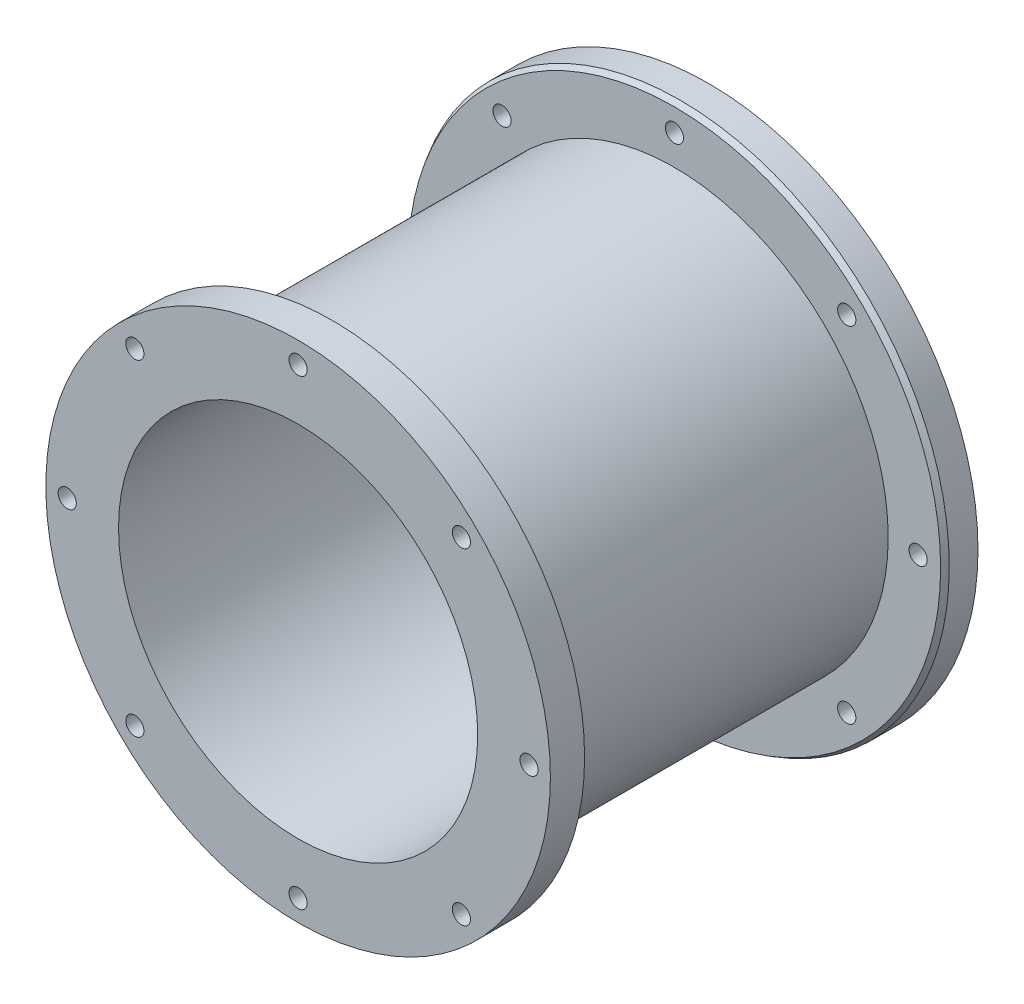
SolidWorks part; units mm, degrees
ref_plane "FRONT" through (0, 0, 0) normal (0, 0, 1) x (1, 0, 0)
ref_plane "TOP" through (0, 0, 0) normal (0, 1, 0) x (1, 0, 0)
ref_plane "RT-SIDE" through (0, 0, 0) normal (1, 0, 0) x (0, 0, -1)
sketch "Sketch1" plane through (0, 0, 0) normal (0, 0, 1) x (1, 0, 0)
  circle A0 centre (0, 0) radius 66.675
  circle A1 centre (0, 0) radius 100.0125
  dimension "D1" = 200.025
  dimension "D2" = 133.35
extrude "Base-Extrude" add sketch "Sketch1" along normal blind 12.7
sketch "Sketch2" plane through (0, 0, 12.7) normal (0, 0, 1) x (1, 0, 0)
  circle A0 centre (0, 0) radius 66.675
  circle A1 centre (0, 0) radius 79.375
  circle A2 centre (0, 0) radius 66.675 construction
  dimension "D2" = 158.75
  dimension "D1" = 12.7
extrude "Boss-Extrude1" add sketch "Sketch2" along normal blind 127
ref_plane "Plane1" through (0, 0, 76.2) normal (0, 0, 1) x (1, 0, 0)
hole_wizard "1/4 Clearance" positions "Sketch4" profile "Sketch3" hole size "1/4" standard "Ansi Inch"
sketch "Sketch4" plane through (0, 0, 0) normal (0, 0, -1) x (-1, 0, 0)
  line L0 (0, 0) -> (0, 90.4875) construction
  point P0 (0, 90.4875)
  dimension "D1" = 90.4875
sketch "Sketch3" plane through (0, 90.4875, 0) normal (1, 0, 0) x (0, 1, 0)
  line L0 (0, 0) -> (0, 139.7)
  line L1 (0, 139.7) -> (3.3782, 139.7)
  line L2 (3.3782, 139.7) -> (3.3782, 0)
  line L5 (3.3782, 0) -> (0, 0)
  line L11 (0, -6.35) -> (0, 107.95) construction
  dimension "Thru Hole Dia." = 6.7564
  dimension "Thru Hole Depth" = 139.7
pattern_circular "CirPattern1" count 8 over 360
sketch "Sketch5" plane through (0, 0, 139.7) normal (0, 0, 1) x (1, 0, 0)
  circle A0 centre (0, 0) radius 66.675
  circle A1 centre (0, 0) radius 93.6625
  dimension "D1" = 187.325
extrude "Boss-Extrude2" add sketch "Sketch5" along normal blind 12.7
hole_wizard "1/4 clearance-2" positions "Sketch7" profile "Sketch6" hole size "1/4" standard "Ansi Inch"
sketch "Sketch7" plane through (0, 0, 152.4) normal (0, 0, 1) x (1, 0, 0)
  line L0 (0, 0) -> (0, 85.725) construction
  point P0 (0, 85.725)
  dimension "D1" = 85.725
sketch "Sketch6" plane through (0, 85.725, 152.4) normal (1, 0, 0) x (0, -1, 0)
  line L0 (0, 0) -> (0, 33.7798)
  line L1 (0, 33.7798) -> (3.3782, 31.75)
  line L2 (3.3782, 31.75) -> (3.3782, 0)
  line L5 (3.3782, 0) -> (0, 0)
  line L10 (0, 33.7798) -> (-3.3782, 31.75) construction
  line L11 (0, -6.35) -> (0, 107.95) construction
  dimension "Hole Dia." = 6.7564
  dimension "Hole Depth" = 31.75
  dimension "Drill Angle" = 118
pattern_circular "CirPattern2" count 8 over 360
ref_plane "Plane2" through (0, 0, 0) normal (-1, 0, 0) x (0, 1, 0)
ref_plane "Plane3" through (0, 0, 0) normal (-1, 0, 0) x (0, 1, 0)
sketch "Sketch9" plane through (0, 0, 0) normal (-1, 0, 0) x (0, 1, 0)
  line L0 (74.4092, -2.2358) -> (74.2136, 0)
  line L1 (74.2136, 0) -> (79.2276, 0)
  line L2 (79.2276, 0) -> (79.032, -2.2358)
  line L3 (78.5892, -2.6416) -> (74.852, -2.6416)
  line L4 (0, 50) -> (0, -50) construction
  arc A0 (79.032, -2.2358) -> (78.5892, -2.6416) centre (78.5892, -2.1971) cw
  arc A1 (74.852, -2.6416) -> (74.4092, -2.2358) centre (74.852, -2.1971) cw
revolve "Groove for AS 568-257, O-Ring1" cut sketch "Sketch9"
chamfer "Chamfer1" distance 2.032 angle 30
